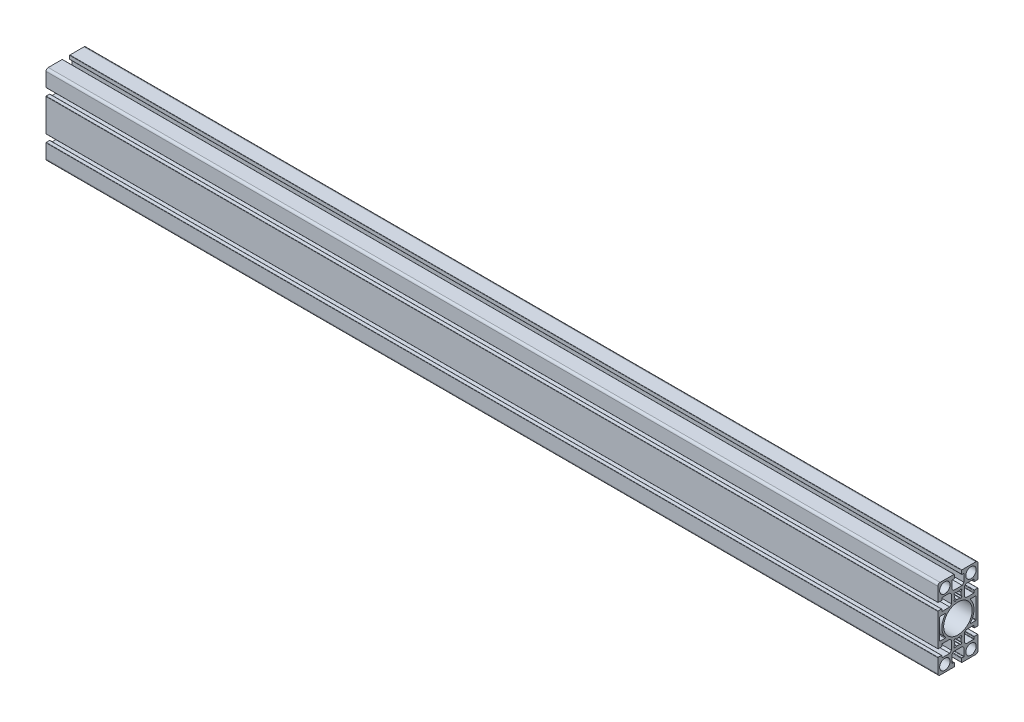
SolidWorks part; units mm, degrees
ref_plane "Front Plane" through (0, 0, 0) normal (0, 0, 1) x (1, 0, 0)
ref_plane "Top Plane" through (0, 0, 0) normal (0, 1, 0) x (1, 0, 0)
ref_plane "Right Plane" through (0, 0, 0) normal (1, 0, 0) x (0, 0, -1)
sketch3d "3DSketch1"
  line L0 (0, 0, 0) -> (1000, 0, 0)
  dimension "D1" = 1000
other "45-sarja 1.0109 45X90 VAHVA L(1)"
ref_plane "Plane1" through (0, 0, 0) normal (1, 0, 0) x (0, 0, -1)
sketch "Model6" plane through (0, 0, 0) normal (1, 0, 0) x (0, 0, -1)
  line L0 (1.9491, 19.1367) -> (2.9698, 18.1159)
  line L1 (3.3941, 18.1159) -> (4.3841, 19.1059)
  line L2 (4.3841, 19.5302) -> (3.3633, 20.5509)
  line L3 (3.3633, 24.4491) -> (4.3841, 25.4698)
  line L4 (4.3841, 25.8941) -> (3.3941, 26.8841)
  line L5 (2.9698, 26.8841) -> (1.9491, 25.8633)
  line L6 (-1.9491, 25.8633) -> (-2.9698, 26.8841)
  line L7 (-3.3941, 26.8841) -> (-4.3841, 25.8941)
  line L8 (-4.3841, 25.4698) -> (-3.3633, 24.4491)
  line L9 (-3.3633, 20.5509) -> (-4.3841, 19.5302)
  line L10 (-4.3841, 19.1059) -> (-3.3941, 18.1159)
  line L11 (-2.9698, 18.1159) -> (-1.9491, 19.1367)
  line L12 (4.6, 40.5) -> (6.5, 40.5)
  line L13 (4.1, 44.7) -> (4.1, 41)
  line L14 (20, 45) -> (4.4, 45)
  line L15 (22.5, 26.9) -> (22.5, 42.5)
  line L16 (18.5, 26.6) -> (22.2, 26.6)
  line L17 (18, 29) -> (18, 27.1)
  line L18 (9.2, 29.3) -> (17.7, 29.3)
  line L19 (7.2, 27.3) -> (9.2, 29.3)
  line L20 (7.2, 17.7) -> (7.2, 27.3)
  line L21 (9.2, 15.7) -> (7.2, 17.7)
  line L22 (17.7, 15.7) -> (9.2, 15.7)
  line L23 (18, 17.9) -> (18, 16)
  line L24 (22.2, 18.4) -> (18.5, 18.4)
  line L25 (22.5, -18.1) -> (22.5, 18.1)
  line L26 (18.5, -18.4) -> (22.2, -18.4)
  line L27 (18, -15.8) -> (18, -17.7)
  line L28 (9.2, -15.5) -> (17.7, -15.5)
  line L29 (7.2, -17.5) -> (9.2, -15.5)
  line L30 (7.2, -27.1) -> (7.2, -17.5)
  line L31 (9.2, -29.1) -> (7.2, -27.1)
  line L32 (17.7, -29.1) -> (9.2, -29.1)
  line L33 (18, -26.9) -> (18, -28.8)
  line L34 (22.2, -26.6) -> (18.5, -26.6)
  line L35 (22.5, -42.5) -> (22.5, -26.9)
  line L36 (4.4, -45) -> (20, -45)
  line L37 (4.1, -41) -> (4.1, -44.7)
  line L38 (6.5, -40.5) -> (4.6, -40.5)
  line L39 (6.8, -31.7) -> (6.8, -40.2)
  line L40 (4.8, -29.7) -> (6.8, -31.7)
  line L41 (-4.8, -29.7) -> (4.8, -29.7)
  line L42 (-6.8, -31.7) -> (-4.8, -29.7)
  line L43 (-6.8, -40.2) -> (-6.8, -31.7)
  line L44 (-4.6, -40.5) -> (-6.5, -40.5)
  line L45 (-4.1, -44.7) -> (-4.1, -41)
  line L46 (-20, -45) -> (-4.4, -45)
  line L47 (-22.5, -26.9) -> (-22.5, -42.5)
  line L48 (-18.5, -26.6) -> (-22.2, -26.6)
  line L49 (-18, -29) -> (-18, -27.1)
  line L50 (-9.2, -29.3) -> (-17.7, -29.3)
  line L51 (-7.2, -27.3) -> (-9.2, -29.3)
  line L52 (-7.2, -17.7) -> (-7.2, -27.3)
  line L53 (-9.2, -15.7) -> (-7.2, -17.7)
  line L54 (-17.7, -15.7) -> (-9.2, -15.7)
  line L55 (-18, -17.9) -> (-18, -16)
  line L56 (-22.2, -18.4) -> (-18.5, -18.4)
  line L57 (-22.5, 18.1) -> (-22.5, -18.1)
  line L58 (-18.5, 18.4) -> (-22.2, 18.4)
  line L59 (-18, 16) -> (-18, 17.9)
  line L60 (-9.2, 15.7) -> (-17.7, 15.7)
  line L61 (-7.2, 17.7) -> (-9.2, 15.7)
  line L62 (-7.2, 27.3) -> (-7.2, 17.7)
  line L63 (-9.2, 29.3) -> (-7.2, 27.3)
  line L64 (-17.7, 29.3) -> (-9.2, 29.3)
  line L65 (-18, 27.1) -> (-18, 29)
  line L66 (-22.2, 26.6) -> (-18.5, 26.6)
  line L67 (-22.5, 42.5) -> (-22.5, 26.9)
  line L68 (-4.4, 45) -> (-20, 45)
  line L69 (-4.1, 41) -> (-4.1, 44.7)
  line L70 (-6.5, 40.5) -> (-4.6, 40.5)
  line L71 (-6.8, 31.7) -> (-6.8, 40.2)
  line L72 (-4.8, 29.7) -> (-6.8, 31.7)
  line L73 (4.8, 29.7) -> (-4.8, 29.7)
  line L74 (6.8, 31.7) -> (4.8, 29.7)
  line L75 (6.8, 40.2) -> (6.8, 31.7)
  line L76 (-3.3941, -18.1159) -> (-4.3841, -19.1059)
  line L77 (-4.3841, -19.5302) -> (-3.3633, -20.5509)
  line L78 (-3.3633, -24.4491) -> (-4.3841, -25.4698)
  line L79 (-4.3841, -25.8941) -> (-3.3941, -26.8841)
  line L80 (-2.9698, -26.8841) -> (-1.9491, -25.8633)
  line L81 (1.9491, -25.8633) -> (2.9698, -26.8841)
  line L82 (3.3941, -26.8841) -> (4.3841, -25.8941)
  line L83 (4.3841, -25.4698) -> (3.3633, -24.4491)
  line L84 (3.3633, -20.5509) -> (4.3841, -19.5302)
  line L85 (4.3841, -19.1059) -> (3.3941, -18.1159)
  line L86 (2.9698, -18.1159) -> (1.9491, -19.1367)
  line L87 (-1.9491, -19.1367) -> (-2.9698, -18.1159)
  line L88 (-20.5, 11.5) -> (-20.5, -11.5)
  line L89 (20.5, 11.5) -> (20.5, -11.5)
  line L90 (-20, 12) -> (-14.4914, 12)
  line L91 (-20, -12) -> (-14.4914, -12)
  line L92 (20, -12) -> (14.4914, -12)
  line L93 (20, 12) -> (14.4914, 12)
  circle A0 centre (-14.65, 37.15) radius 5.85
  arc A1 (2.9698, 18.1159) -> (3.3941, 18.1159) centre (3.182, 18.3281) ccw
  arc A2 (4.3841, 19.1059) -> (4.3841, 19.5302) centre (4.1719, 19.318) ccw
  arc A3 (3.3056, 20.8941) -> (3.3633, 20.5509) centre (3.5754, 20.7631) ccw
  arc A4 (3.3056, 20.8941) -> (3.3056, 24.1059) centre (0, 22.5) ccw
  arc A5 (3.3633, 24.4491) -> (3.3056, 24.1059) centre (3.5754, 24.2369) ccw
  arc A6 (4.3841, 25.4698) -> (4.3841, 25.8941) centre (4.1719, 25.682) ccw
  arc A7 (3.3941, 26.8841) -> (2.9698, 26.8841) centre (3.182, 26.6719) ccw
  arc A8 (1.6059, 25.8056) -> (1.9491, 25.8633) centre (1.7369, 26.0754) ccw
  arc A9 (1.6059, 25.8056) -> (-1.6059, 25.8056) centre (0, 22.5) ccw
  arc A10 (-1.9491, 25.8633) -> (-1.6059, 25.8056) centre (-1.7369, 26.0754) ccw
  arc A11 (-2.9698, 26.8841) -> (-3.3941, 26.8841) centre (-3.182, 26.6719) ccw
  arc A12 (-4.3841, 25.8941) -> (-4.3841, 25.4698) centre (-4.1719, 25.682) ccw
  arc A13 (-3.3056, 24.1059) -> (-3.3633, 24.4491) centre (-3.5754, 24.2369) ccw
  arc A14 (-3.3056, 24.1059) -> (-3.3056, 20.8941) centre (0, 22.5) ccw
  arc A15 (-3.3633, 20.5509) -> (-3.3056, 20.8941) centre (-3.5754, 20.7631) ccw
  arc A16 (-4.3841, 19.5302) -> (-4.3841, 19.1059) centre (-4.1719, 19.318) ccw
  arc A17 (-3.3941, 18.1159) -> (-2.9698, 18.1159) centre (-3.182, 18.3281) ccw
  arc A18 (-1.6059, 19.1944) -> (-1.9491, 19.1367) centre (-1.7369, 18.9246) ccw
  arc A19 (-1.6059, 19.1944) -> (1.6059, 19.1944) centre (0, 22.5) ccw
  arc A20 (1.9491, 19.1367) -> (1.6059, 19.1944) centre (1.7369, 18.9246) ccw
  circle A21 centre (0, 0) radius 16
  circle A22 centre (14.65, -37.15) radius 5.85
  arc A23 (4.1, 41) -> (4.6, 40.5) centre (4.6, 41) ccw
  arc A24 (4.4, 45) -> (4.1, 44.7) centre (4.4, 44.7) ccw
  arc A25 (22.5, 42.5) -> (20, 45) centre (20, 42.5) ccw
  arc A26 (22.2, 26.6) -> (22.5, 26.9) centre (22.2, 26.9) ccw
  arc A27 (18, 27.1) -> (18.5, 26.6) centre (18.5, 27.1) ccw
  arc A28 (18, 29) -> (17.7, 29.3) centre (17.7, 29) ccw
  arc A29 (17.7, 15.7) -> (18, 16) centre (17.7, 16) ccw
  arc A30 (18.5, 18.4) -> (18, 17.9) centre (18.5, 17.9) ccw
  arc A31 (22.5, 18.1) -> (22.2, 18.4) centre (22.2, 18.1) ccw
  arc A32 (22.2, -18.4) -> (22.5, -18.1) centre (22.2, -18.1) ccw
  arc A33 (18, -17.7) -> (18.5, -18.4) centre (18.4575, -17.9018) ccw
  arc A34 (18, -15.8) -> (17.7, -15.5) centre (17.7, -15.8) ccw
  arc A35 (17.7, -29.1) -> (18, -28.8) centre (17.7, -28.8) ccw
  arc A36 (18.5, -26.6) -> (18, -26.9) centre (18.459, -27.0983) ccw
  arc A37 (22.5, -26.9) -> (22.2, -26.6) centre (22.2, -26.9) ccw
  arc A38 (20, -45) -> (22.5, -42.5) centre (20, -42.5) ccw
  arc A39 (4.1, -44.7) -> (4.4, -45) centre (4.4, -44.7) ccw
  arc A40 (4.6, -40.5) -> (4.1, -41) centre (4.6, -41) ccw
  arc A41 (6.5, -40.5) -> (6.8, -40.2) centre (6.5, -40.2) ccw
  arc A42 (-6.8, -40.2) -> (-6.5, -40.5) centre (-6.5, -40.2) ccw
  arc A43 (-4.1, -41) -> (-4.6, -40.5) centre (-4.6, -41) ccw
  arc A44 (-4.4, -45) -> (-4.1, -44.7) centre (-4.4, -44.7) ccw
  arc A45 (-22.5, -42.5) -> (-20, -45) centre (-20, -42.5) ccw
  arc A46 (-22.2, -26.6) -> (-22.5, -26.9) centre (-22.2, -26.9) ccw
  arc A47 (-18, -27.1) -> (-18.5, -26.6) centre (-18.5, -27.1) ccw
  arc A48 (-18, -29) -> (-17.7, -29.3) centre (-17.7, -29) ccw
  arc A49 (-17.7, -15.7) -> (-18, -16) centre (-17.7, -16) ccw
  arc A50 (-18.5, -18.4) -> (-18, -17.9) centre (-18.5, -17.9) ccw
  arc A51 (-22.5, -18.1) -> (-22.2, -18.4) centre (-22.2, -18.1) ccw
  arc A52 (-22.2, 18.4) -> (-22.5, 18.1) centre (-22.2, 18.1) ccw
  arc A53 (-18, 17.9) -> (-18.5, 18.4) centre (-18.5, 17.9) ccw
  arc A54 (-18, 16) -> (-17.7, 15.7) centre (-17.7, 16) ccw
  arc A55 (-17.7, 29.3) -> (-18, 29) centre (-17.7, 29) ccw
  arc A56 (-18.5, 26.6) -> (-18, 27.1) centre (-18.5, 27.1) ccw
  arc A57 (-22.5, 26.9) -> (-22.2, 26.6) centre (-22.2, 26.9) ccw
  arc A58 (-20, 45) -> (-22.5, 42.5) centre (-20, 42.5) ccw
  arc A59 (-4.1, 44.7) -> (-4.4, 45) centre (-4.4, 44.7) ccw
  arc A60 (-4.6, 40.5) -> (-4.1, 41) centre (-4.6, 41) ccw
  arc A61 (-6.5, 40.5) -> (-6.8, 40.2) centre (-6.5, 40.2) ccw
  arc A62 (6.8, 40.2) -> (6.5, 40.5) centre (6.5, 40.2) ccw
  circle A63 centre (-14.65, -37.15) radius 5.85
  arc A64 (-2.9698, -18.1159) -> (-3.3941, -18.1159) centre (-3.182, -18.3281) ccw
  arc A65 (-4.3841, -19.1059) -> (-4.3841, -19.5302) centre (-4.1719, -19.318) ccw
  arc A66 (-3.3056, -20.8941) -> (-3.3633, -20.5509) centre (-3.5754, -20.7631) ccw
  arc A67 (-3.3056, -20.8941) -> (-3.3056, -24.1059) centre (0, -22.5) ccw
  arc A68 (-3.3633, -24.4491) -> (-3.3056, -24.1059) centre (-3.5754, -24.2369) ccw
  arc A69 (-4.3841, -25.4698) -> (-4.3841, -25.8941) centre (-4.1719, -25.682) ccw
  arc A70 (-3.3941, -26.8841) -> (-2.9698, -26.8841) centre (-3.182, -26.6719) ccw
  arc A71 (-1.6059, -25.8056) -> (-1.9491, -25.8633) centre (-1.7369, -26.0754) ccw
  arc A72 (-1.6059, -25.8056) -> (1.6059, -25.8056) centre (0, -22.5) ccw
  arc A73 (1.9491, -25.8633) -> (1.6059, -25.8056) centre (1.7369, -26.0754) ccw
  arc A74 (2.9698, -26.8841) -> (3.3941, -26.8841) centre (3.182, -26.6719) ccw
  arc A75 (4.3841, -25.8941) -> (4.3841, -25.4698) centre (4.1719, -25.682) ccw
  arc A76 (3.3056, -24.1059) -> (3.3633, -24.4491) centre (3.5754, -24.2369) ccw
  arc A77 (3.3056, -24.1059) -> (3.3056, -20.8941) centre (0, -22.5) ccw
  arc A78 (3.3633, -20.5509) -> (3.3056, -20.8941) centre (3.5754, -20.7631) ccw
  arc A79 (4.3841, -19.5302) -> (4.3841, -19.1059) centre (4.1719, -19.318) ccw
  arc A80 (3.3941, -18.1159) -> (2.9698, -18.1159) centre (3.182, -18.3281) ccw
  arc A81 (1.6059, -19.1944) -> (1.9491, -19.1367) centre (1.7369, -18.9246) ccw
  arc A82 (1.6059, -19.1944) -> (-1.6059, -19.1944) centre (0, -22.5) ccw
  arc A83 (-1.9491, -19.1367) -> (-1.6059, -19.1944) centre (-1.7369, -18.9246) ccw
  circle A84 centre (14.65, 37.15) radius 5.85
  arc A85 (-14.0997, 11.1892) -> (-14.0997, -11.1892) centre (0, 0) ccw
  circle A86 centre (0, 0) radius 18 construction
  arc A87 (14.0997, -11.1892) -> (14.0997, 11.1892) centre (0, 0) ccw
  arc A88 (20.5, 11.5) -> (20, 12) centre (20, 11.5) ccw
  arc A89 (14.0997, 11.1892) -> (14.4914, 12) centre (14.4914, 11.5) cw
  arc A90 (20.5, -11.5) -> (20, -12) centre (20, -11.5) cw
  arc A91 (14.4914, -12) -> (14.0997, -11.1892) centre (14.4914, -11.5) cw
  arc A92 (-14.4914, -12) -> (-14.0997, -11.1892) centre (-14.4914, -11.5) ccw
  arc A93 (-20.5, -11.5) -> (-20, -12) centre (-20, -11.5) ccw
  arc A94 (-14.4914, 12) -> (-14.0997, 11.1892) centre (-14.4914, 11.5) cw
  arc A95 (-20.5, 11.5) -> (-20, 12) centre (-20, 11.5) cw
  point P252 (-22.5, 0)
  point P253 (0, 0)
  point P254 (22.5, 0)
  point P255 (0, 22.5)
  point P256 (0, -22.5)
  point P257 (-22.5, 45)
  point P258 (22.5, 45)
  point P259 (22.5, -45)
  point P260 (-22.5, -45)
  point P261 (0, -45)
  point P262 (0, 45)
  point P266 (-20.5, 0)
  point P269 (20.5, 0)
  point P277 (20.5, 12)
  point P282 (20.5, -12)
  point P285 (13.4164, -12)
  point P294 (-22.5, 22.5)
  point P295 (22.5, 22.5)
  point P296 (-22.5, -22.5)
  point P297 (22.5, -22.5)
  point P298 (0, 0)
